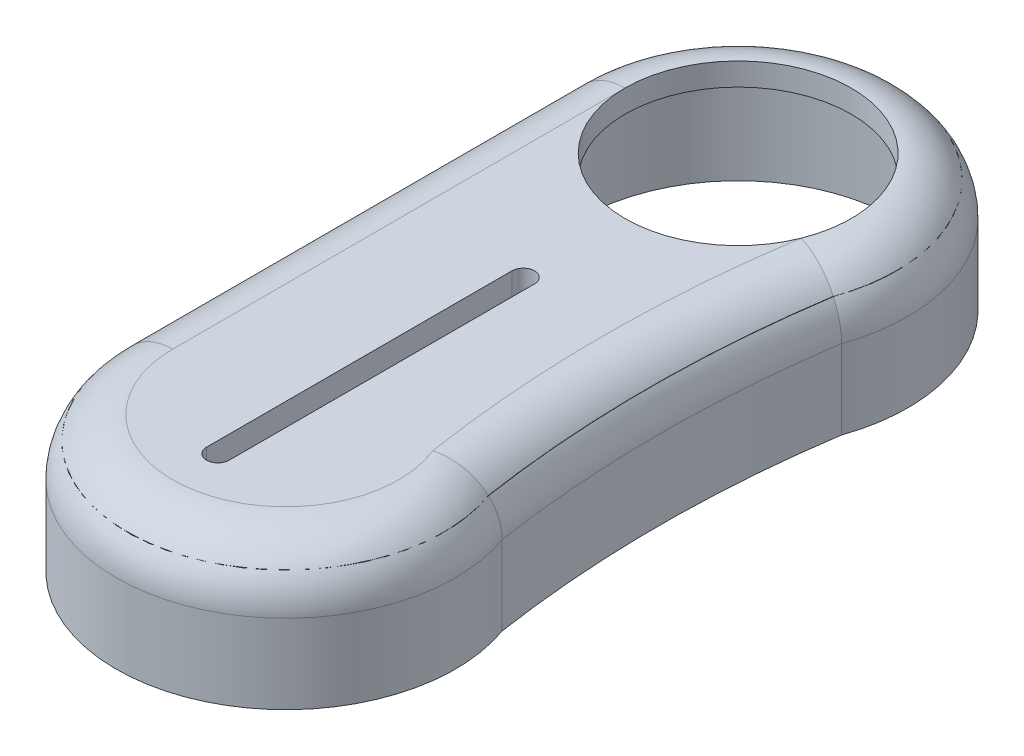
SolidWorks part; units mm, degrees
ref_plane "Front Plane" through (0, 0, 0) normal (0, 0, 1) x (1, 0, 0)
ref_plane "Top Plane" through (0, 0, 0) normal (0, 1, 0) x (1, 0, 0)
ref_plane "Right Plane" through (0, 0, 0) normal (1, 0, 0) x (0, 0, -1)
sketch "Sketch1" plane through (0, 0, 0) normal (0, 1, 0) x (1, 0, 0)
  line L0 (0, 0) -> (0, 40)
  line L1 (-30, 40) -> (-30, 0)
  arc A0 (0, 40) -> (-30, 40) centre (-15, 40) ccw
  arc A1 (-30, 0) -> (0, 0) centre (-15, 0) ccw
  arc A2 (0, 40) -> (-0.8579, 35) centre (-15, 40) cw
  arc A3 (0, 0) -> (-0.8579, 5) centre (-15, 0) ccw
  arc A4 (-0.8579, 35) -> (-0.8579, 5) centre (98.0107, 20) ccw
  point P7 (-15, 55)
  point P8 (-15, -15)
  point P12 (-1.9893, 20)
  point P13 (0, 20)
  dimension "D3" = 100
  dimension "D1" = 70
  dimension "D2" = 30
  dimension "D4" = 30
extrude "Boss-Extrude1" add sketch "Sketch1" along normal blind 2 contours A4 A2 A0 L1 A1 A3
sketch "Sketch2" plane through (0, 2, 0) normal (0, 1, 0) x (1, 0, 0)
  line L0 (-15, 55) -> (-15, -15) construction
  line L1 (-15, 21) -> (-15, -6) construction
  line L2 (-14, 21) -> (-14, -6)
  line L3 (-16, 21) -> (-16, -6)
  arc A0 (-0.8579, 35) -> (-30, 40) centre (-15, 40) ccw construction
  arc A1 (-30, 0) -> (-0.8579, 5) centre (-15, 0) ccw construction
  circle A2 centre (-15, 40) radius 10
  arc A3 (-14, 21) -> (-16, 21) centre (-15, 21) ccw
  arc A4 (-16, -6) -> (-14, -6) centre (-15, -6) ccw
  point P13 (-15, 7.5)
  dimension "D2" = 20
  dimension "D3" = 7.5
  dimension "D1" = 2
  dimension "D4" = 27
extrude "Cut-Extrude1" cut sketch "Sketch2" against normal through all and the other way through all
sketch "Sketch3" plane through (0, 0, 0) normal (0, -1, 0) x (1, 0, 0)
  line L1 (-30, 0) -> (-30, -40)
  line L2 (-29, 0) -> (-29, -40)
  line L3 (-29, 0) -> (-29, -40)
  arc A3 (-30, -40) -> (-0.8579, -35) centre (-15, -40) ccw
  arc A4 (-0.8579, -5) -> (-0.8579, -35) centre (98.0107, -20) ccw
  arc A5 (-0.8579, -5) -> (-30, 0) centre (-15, 0) ccw
  arc A6 (-1.832, -4.7543) -> (-1.832, -35.2457) centre (98.0107, -20) ccw
  arc A7 (-1.832, -4.7543) -> (-29, 0) centre (-15, 0) ccw
  arc A8 (-29, -40) -> (-1.832, -35.2457) centre (-15, -40) ccw
  arc A9 (-1.832, -4.7543) -> (-1.832, -35.2457) centre (98.0107, -20) ccw
  arc A10 (-1.832, -4.7543) -> (-29, 0) centre (-15, 0) ccw
  arc A11 (-29, -40) -> (-1.832, -35.2457) centre (-15, -40) ccw
  dimension "D1" = 1
  dimension "D2" = 1
extrude "Boss-Extrude2" add sketch "Sketch3" along normal blind 10 contours L1 A3 A4 A5
sketch "Sketch4" plane through (-30, 0, 0) normal (-1, 0, 0) x (0, 0, 1)
  line L0 (-21, -4) -> (-19, -4) construction
  line L3 (-40, -4) -> (0, -4) construction
  line L4 (-40, 2) -> (-40, -10) construction
  line L5 (0, 2) -> (0, -10) construction
  line L6 (-20, 2) -> (-20, -10) construction
  line L7 (-40, 2) -> (0, 2) construction
  line L8 (0, -10) -> (-40, -10) construction
  line L9 (-21, -3) -> (-19, -3)
  line L10 (-21, -5) -> (-19, -5)
  arc A2 (-21, -3) -> (-21, -5) centre (-21, -4) ccw
  arc A3 (-19, -5) -> (-19, -3) centre (-19, -4) ccw
  circle A4 centre (-16.5, -4) radius 0.625
  point P2 (-20, -4)
  dimension "D2" = 1
  dimension "D3" = 1.25
  dimension "D1" = 2
  dimension "D4" = 2.5
extrude "Cut-Extrude2" cut sketch "Sketch4" against normal up to next
fillet "Fillet1" radius 5 4 edges at (-12.4635, 2, -54.784) (-1.9893, 2, -20) (-12.4635, 2, 14.784) (-30, 2, -20)
